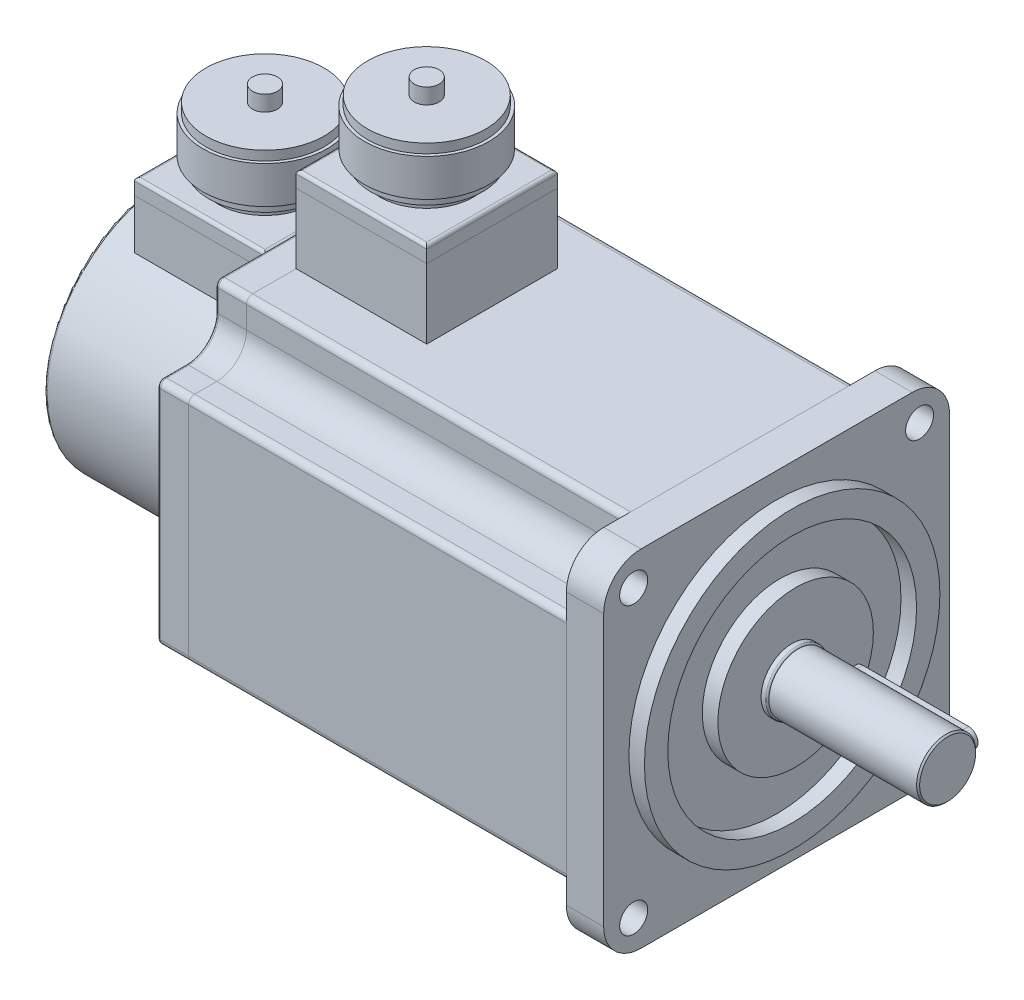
SolidWorks part; units mm, degrees
ref_plane "前视基准面" through (0, 0, 0) normal (0, 0, 1) x (1, 0, 0)
ref_plane "上视基准面" through (0, 0, 0) normal (0, 1, 0) x (1, 0, 0)
ref_plane "右视基准面" through (0, 0, 0) normal (1, 0, 0) x (0, 0, -1)
sketch "草图1" plane through (0, 0, 0) normal (1, 0, 0) x (0, 0, -1)
  line L1 (-43.6, -55.6) -> (43.6, -55.6)
  line L2 (-55.6, -43.6) -> (-55.6, 43.6)
  line L3 (-43.6, 55.6) -> (43.6, 55.6)
  line L4 (55.6, -43.6) -> (55.6, 43.6)
  line L5 (-55.6, -55.6) -> (55.6, 55.6) construction
  line L6 (-55.6, 55.6) -> (55.6, -55.6) construction
  arc A0 (-43.6, -55.6) -> (-55.6, -43.6) centre (-43.6, -43.6) cw
  arc A1 (43.6, -55.6) -> (55.6, -43.6) centre (43.6, -43.6) ccw
  arc A2 (43.6, 55.6) -> (55.6, 43.6) centre (43.6, 43.6) cw
  arc A3 (-55.6, 43.6) -> (-43.6, 55.6) centre (-43.6, 43.6) cw
  point P0 (0, 0)
  dimension "D1" = 12
extrude "凸台-拉伸1" add sketch "草图1" along normal blind 10
sketch "草图2" plane through (10, 0, 0) normal (1, 0, 0) x (0, 0, -1)
  line L0 (43.6, 55.6) -> (-43.6, 55.6) construction
  line L1 (-43.6, -55.6) -> (43.6, -55.6)
  line L2 (-55.6, -43.6) -> (-55.6, 43.6)
  line L3 (-43.6, 55.6) -> (43.6, 55.6)
  line L4 (55.6, -43.6) -> (55.6, 43.6)
  line L5 (-55.6, -55.6) -> (55.6, 55.6) construction
  line L6 (-55.6, 55.6) -> (55.6, -55.6) construction
  arc A0 (43.6, 55.6) -> (55.6, 43.6) centre (43.6, 43.6) cw
  arc A1 (43.6, -55.6) -> (55.6, -43.6) centre (43.6, -43.6) ccw
  arc A2 (-43.6, -55.6) -> (-55.6, -43.6) centre (-43.6, -43.6) cw
  arc A3 (-55.6, 43.6) -> (-43.6, 55.6) centre (-43.6, 43.6) cw
  point P0 (0, 0)
  dimension "D1" = 12
extrude "凸台-拉伸2" add sketch "草图2" along normal blind 121.5 separate body
sketch "草图3" plane through (131.5, 0, 0) normal (1, 0, 0) x (0, 0, -1)
  line L0 (43.6, 55.6) -> (-43.6, 55.6) construction
  line L1 (-43.6, -55.6) -> (43.6, -55.6)
  line L2 (-55.6, -43.6) -> (-55.6, 43.6)
  line L3 (-43.6, 55.6) -> (43.6, 55.6)
  line L4 (55.6, -43.6) -> (55.6, 43.6)
  line L5 (-55.6, -55.6) -> (55.6, 55.6) construction
  line L6 (-55.6, 55.6) -> (55.6, -55.6) construction
  arc A0 (43.6, 55.6) -> (55.6, 43.6) centre (43.6, 43.6) cw
  arc A1 (43.6, -55.6) -> (55.6, -43.6) centre (43.6, -43.6) ccw
  arc A2 (-43.6, -55.6) -> (-55.6, -43.6) centre (-43.6, -43.6) cw
  arc A3 (-55.6, 43.6) -> (-43.6, 55.6) centre (-43.6, 43.6) cw
  point P0 (0, 0)
  dimension "D1" = 12
extrude "凸台-拉伸3" add sketch "草图3" along normal blind 12 separate body
sketch "草图6" plane through (0, 0, 0) normal (-1, 0, 0) x (0, 0, 1)
  line L0 (-46.5, 36.9491) -> (-53.6, 36.9491)
  line L1 (-55.6, 34.9491) -> (-55.6, 43.6)
  line L3 (-43.6, 55.6) -> (-34.9491, 55.6)
  line L4 (34.9491, 55.6) -> (43.6, 55.6)
  line L6 (55.6, 43.6) -> (55.6, 34.9491)
  line L7 (-55.6, -43.6) -> (-55.6, 43.6) construction
  line L9 (-53.6, -36.9491) -> (-46.5, -36.9491)
  line L10 (55.6, -34.9491) -> (55.6, -43.6)
  line L11 (-36.9491, -46.5) -> (-36.9491, -53.6)
  line L12 (43.6, -55.6) -> (-43.6, -55.6) construction
  line L14 (36.9491, -53.6) -> (36.9491, -46.5)
  line L16 (46.5, -36.9491) -> (53.6, -36.9491)
  line L17 (55.6, 43.6) -> (55.6, -43.6) construction
  line L19 (53.6, 36.9491) -> (46.5, 36.9491)
  line L20 (43.6, -55.6) -> (34.9491, -55.6)
  line L21 (36.9491, 46.5) -> (36.9491, 53.6)
  line L24 (-43.6, 55.6) -> (43.6, 55.6) construction
  line L25 (-36.9491, 53.6) -> (-36.9491, 46.5)
  line L26 (-34.9491, -55.6) -> (-43.6, -55.6)
  line L28 (-55.6, -43.6) -> (-55.6, -34.9491)
  arc A0 (-46.5, 36.9491) -> (-36.9491, 46.5) centre (-46.5, 46.5) ccw
  arc A1 (36.9491, 46.5) -> (46.5, 36.9491) centre (46.5, 46.5) ccw
  arc A2 (-36.9491, -46.5) -> (-46.5, -36.9491) centre (-46.5, -46.5) ccw
  arc A3 (46.5, -36.9491) -> (36.9491, -46.5) centre (46.5, -46.5) ccw
  arc A4 (-34.9491, 55.6) -> (-36.9491, 53.6) centre (-34.9491, 53.6) ccw
  arc A5 (36.9491, 53.6) -> (34.9491, 55.6) centre (34.9491, 53.6) ccw
  arc A6 (55.6, 34.9491) -> (53.6, 36.9491) centre (53.6, 34.9491) ccw
  arc A7 (53.6, -36.9491) -> (55.6, -34.9491) centre (53.6, -34.9491) ccw
  arc A8 (34.9491, -55.6) -> (36.9491, -53.6) centre (34.9491, -53.6) ccw
  arc A9 (-36.9491, -53.6) -> (-34.9491, -55.6) centre (-34.9491, -53.6) ccw
  arc A10 (-55.6, -34.9491) -> (-53.6, -36.9491) centre (-53.6, -34.9491) ccw
  arc A11 (-53.6, 36.9491) -> (-55.6, 34.9491) centre (-53.6, 34.9491) ccw
  arc A12 (-43.6, 55.6) -> (-55.6, 43.6) centre (-43.6, 43.6) ccw
  arc A13 (55.6, 43.6) -> (43.6, 55.6) centre (43.6, 43.6) ccw
  arc A14 (43.6, -55.6) -> (55.6, -43.6) centre (43.6, -43.6) ccw
  arc A15 (-55.6, -43.6) -> (-43.6, -55.6) centre (-43.6, -43.6) ccw
  point P0 (0, 0)
  point P10 (-36.9491, 55.6)
  point P41 (55.6, 36.9491)
  point P44 (55.6, -36.9491)
  point P47 (36.9491, -55.6)
  point P50 (-36.9491, -55.6)
  point P53 (-55.6, -36.9491)
  point P56 (-55.6, 36.9491)
  dimension "D1" = 2
extrude "切除-拉伸1" cut sketch "草图6" against normal blind 155
fillet "圆角1" radius 1 24 edges at (0, 55.6, 0) (0, 55.0142, 36.3633) (0, 50.05, 36.9491) (0, 39.7465, 39.7465) (0, 36.9491, 50.05) (0, 36.3633, 55.0142) (0, 0, 55.6) (0, -36.3633, 55.0142) (0, -36.9491, 50.05) (0, -39.7465, 39.7465) (0, -50.05, 36.9491) (0, -55.0142, 36.3633) (0, -55.6, 0) (0, -55.0142, -36.3633) (0, -50.05, -36.9491) (0, -39.7465, -39.7465) (0, -36.9491, -50.05) (0, -36.3633, -55.0142) (0, 0, -55.6) (0, 36.3633, -55.0142) (0, 36.9491, -50.05) (0, 39.7465, -39.7465) (0, 50.05, -36.9491) (0, 55.0142, -36.3633)
sketch "草图7" plane through (143.5, 0, 0) normal (1, 0, 0) x (0, 0, -1)
  circle A2 centre (-45.9619, 45.9619) radius 4.5
  circle A3 centre (45.9619, 45.9619) radius 4.5
  circle A4 centre (45.9619, -45.9619) radius 4.5
  circle A5 centre (-45.9619, -45.9619) radius 4.5
extrude "切除-拉伸2" cut sketch "草图7" against normal blind 12
sketch "草图8" plane through (143.5, 0, 0) normal (1, 0, 0) x (0, 0, -1)
  circle A0 centre (0, 0) radius 47.5
  circle A1 centre (0, 0) radius 40
  circle A2 centre (1.1033, 0) radius 25
extrude "凸台-拉伸4" add sketch "草图8" along normal blind 5 contours A0 A1 | A2
sketch "草图9" plane through (148.5, 0, 0) normal (1, 0, 0) x (0, 0, -1)
  circle A0 centre (0, 0) radius 10
extrude "凸台-拉伸5" add sketch "草图9" along normal blind 2 separate body
sketch "草图10" plane through (150.5, 0, 0) normal (1, 0, 0) x (0, 0, -1)
  circle A0 centre (0, 0) radius 9.5
extrude "凸台-拉伸6" add sketch "草图10" along normal blind 48 separate body
fillet "圆角2" radius 0.5 1 edges at (150.5, 0, -10)
ref_plane "基准面1" through (0, 0, -9.75) normal (0, 0, 1) x (1, 0, 0)
sketch "草图11" plane through (0, 0, -9.75) normal (0, 0, 1) x (1, 0, 0)
  line L4 (193, 3) -> (159, 3)
  line L5 (159, -3) -> (193, -3)
  arc A0 (193, -3) -> (193, 3) centre (193, 0) ccw
  arc A1 (159, 3) -> (159, -3) centre (159, 0) ccw
chamfer "倒角1" distance 0.5 angle 45 1 edges at (198.5, 0, -9.5)
sketch "草图13" plane through (0, 0, 0) normal (-1, 0, 0) x (0, 0, 1)
  circle A0 centre (0, 0) radius 40
extrude "凸台-拉伸8" add sketch "草图13" along normal blind 52 separate body
ref_plane "基准面2" through (0, 40, 0) normal (0, 1, 0) x (1, 0, 0)
sketch "草图14" plane through (0, 40, 0) normal (0, 1, 0) x (1, 0, 0)
  line L2 (-42, -21) -> (0, -21)
  line L3 (-42, -21) -> (-42, 21)
  line L4 (-42, 21) -> (0, 21)
  line L5 (0, -21) -> (0, 21)
  line L6 (-42, -21) -> (0, 21) construction
  line L7 (-42, 21) -> (0, -21) construction
extrude "切除-拉伸4" cut sketch "草图14" against normal blind 10
sketch "草图15" plane through (0, 30, 0) normal (0, 1, 0) x (1, 0, 0)
  line L1 (-42, -21) -> (0, -21)
  line L2 (-42, -21) -> (-42, 21)
  line L3 (-42, 21) -> (0, 21)
  line L4 (0, -21) -> (0, 21)
  line L5 (-42, -21) -> (0, 21) construction
  line L6 (-42, 21) -> (0, -21) construction
  point P0 (-21, 0)
extrude "凸台-拉伸9" add sketch "草图15" along normal blind 20
sketch "草图16" plane through (0, 50, 0) normal (0, 1, 0) x (1, 0, 0)
  line L0 (-42, 21) -> (0, 21) construction
  line L1 (-42, -21) -> (0, -21)
  line L2 (-42, -21) -> (-42, 21)
  line L3 (-42, 21) -> (0, 21)
  line L4 (0, -21) -> (0, 21)
  line L5 (-42, -21) -> (0, 21) construction
  line L6 (-42, 21) -> (0, -21) construction
  line L7 (0, 21) -> (-42, 21) construction
  point P0 (-21, 0)
extrude "凸台-拉伸10" add sketch "草图16" along normal blind 5 separate body
fillet "圆角3" radius 1 4 edges at (-21, 55, 21) (-42, 55, 0) (-21, 55, -21) (0, 55, 0)
sketch "草图17" plane through (0, 55, 0) normal (0, 1, 0) x (1, 0, 0)
  circle A0 centre (-21, 0) radius 15
extrude "凸台-拉伸11" add sketch "草图17" along normal blind 3 separate body
sketch "草图18" plane through (0, 58, 0) normal (0, 1, 0) x (1, 0, 0)
  circle A0 centre (-21, 0) radius 18
extrude "凸台-拉伸12" add sketch "草图18" along normal blind 3
sketch "草图19" plane through (0, 61, 0) normal (0, 1, 0) x (1, 0, 0)
  circle A0 centre (-21, 0) radius 20
extrude "凸台-拉伸13" add sketch "草图19" along normal blind 12
sketch "草图20" plane through (0, 73, 0) normal (0, 1, 0) x (1, 0, 0)
  circle A0 centre (-21, 0) radius 19
extrude "凸台-拉伸14" add sketch "草图20" along normal blind 3
sketch "草图21" plane through (0, 76, 0) normal (0, 1, 0) x (1, 0, 0)
  circle A0 centre (-21, 0) radius 4
extrude "凸台-拉伸15" add sketch "草图21" along normal blind 5
sketch "草图22" plane through (0, 55.6, 0) normal (0, 1, 0) x (1, 0, 0)
  line L3 (10, -21) -> (52, -21)
  line L4 (10, -21) -> (10, 21)
  line L5 (10, 21) -> (52, 21)
  line L6 (52, -21) -> (52, 21)
  line L7 (10, -21) -> (52, 21) construction
  line L8 (10, 21) -> (52, -21) construction
extrude "凸台-拉伸16" add sketch "草图22" along normal blind 22.4 separate body
sketch "草图23" plane through (0, 78, 0) normal (0, 1, 0) x (1, 0, 0)
  line L2 (52, 21) -> (10, 21) construction
  line L4 (10, -21) -> (52, -21)
  line L5 (10, -21) -> (10, 21)
  line L6 (10, 21) -> (52, 21)
  line L7 (52, -21) -> (52, 21)
  line L8 (10, -21) -> (52, 21) construction
  line L9 (10, 21) -> (52, -21) construction
  point P6 (31, 0)
extrude "凸台-拉伸17" add sketch "草图23" along normal blind 5 separate body
fillet "圆角4" radius 1 4 edges at (31, 83, 21) (10, 83, 0) (31, 83, -21) (52, 83, 0)
sketch "草图24" plane through (0, 83, 0) normal (0, 1, 0) x (1, 0, 0)
  circle A0 centre (31, 0) radius 15
extrude "凸台-拉伸18" add sketch "草图24" along normal blind 3 separate body
sketch "草图25" plane through (0, 86, 0) normal (0, 1, 0) x (1, 0, 0)
  circle A0 centre (31, 0) radius 18
extrude "凸台-拉伸19" add sketch "草图25" along normal blind 3 separate body
sketch "草图26" plane through (0, 89, 0) normal (0, 1, 0) x (1, 0, 0)
  circle A0 centre (31, 0) radius 20
extrude "凸台-拉伸20" add sketch "草图26" along normal blind 12 separate body
sketch "草图27" plane through (0, 101, 0) normal (0, 1, 0) x (1, 0, 0)
  circle A0 centre (31, 0) radius 19
extrude "凸台-拉伸21" add sketch "草图27" along normal blind 3 separate body
sketch "草图28" plane through (0, 104, 0) normal (0, 1, 0) x (1, 0, 0)
  circle A0 centre (31, 0) radius 4
extrude "凸台-拉伸22" add sketch "草图28" along normal blind 5 separate body
fillet "圆角5" radius 1 1 edges at (-52, 0, 40)
extrude "切除-拉伸5" cut sketch "草图11" along normal blind 3.5
sketch "草图30" plane through (0, 0, -6.25) normal (0, 0, -1) x (-1, 0, 0)
  line L0 (-193, 3) -> (-159, 3)
  line L2 (-159, -3) -> (-193, -3)
  arc A0 (-193, 3) -> (-193, -3) centre (-193, 0) ccw
  arc A1 (-159, -3) -> (-159, 3) centre (-159, 0) ccw
extrude "凸台-拉伸23" add sketch "草图30" along normal blind 6 separate body
